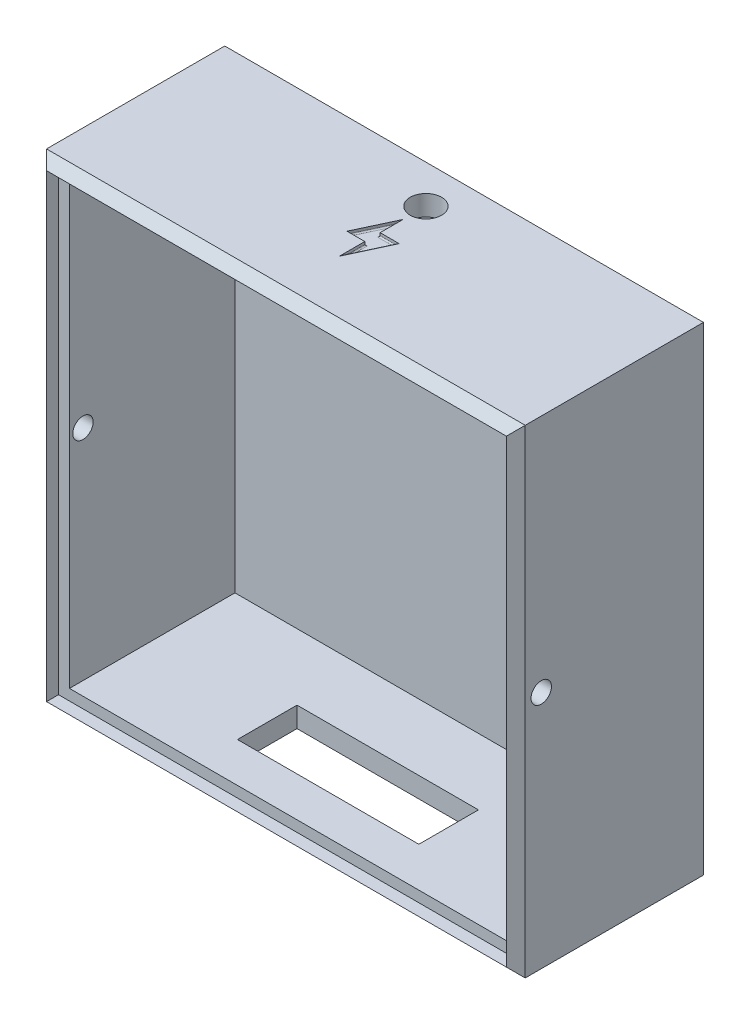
SolidWorks part; units mm, degrees
ref_plane "Ebene vorne" through (0, 0, 0) normal (0, 0, 1) x (1, 0, 0)
ref_plane "Ebene oben" through (0, 0, 0) normal (0, 1, 0) x (1, 0, 0)
ref_plane "Ebene rechts" through (0, 0, 0) normal (1, 0, 0) x (0, 0, -1)
sketch "Skizze1" plane through (0, 0, 0) normal (0, 0, 1) x (1, 0, 0)
  line L1 (-94, -94) -> (94, -94)
  line L2 (-94, -94) -> (-94, 94)
  line L3 (-94, 94) -> (94, 94)
  line L4 (94, -94) -> (94, 94)
  line L5 (-94, -94) -> (94, 94) construction
  line L6 (-94, 94) -> (94, -94) construction
  point P0 (0, 0)
  dimension "D1" = 188
  dimension "D2" = 188
extrude "Aufsatz-Linear austragen1" add sketch "Skizze1" along normal blind 4
sketch "Skizze2" plane through (0, 0, 4) normal (0, 0, 1) x (1, 0, 0)
  line L0 (0, 94) -> (0, -94) construction
  line L1 (94, 94) -> (-94, 94) construction
  line L2 (-94, -94) -> (94, -94) construction
  line L3 (-94, 0) -> (94, 0) construction
  line L4 (-94, 94) -> (-94, -94) construction
  line L5 (94, -94) -> (94, 94) construction
  line L7 (-86, -86) -> (86, -86)
  line L8 (-86, -86) -> (-86, 86)
  line L9 (-86, 86) -> (86, 86)
  line L10 (86, -86) -> (86, 86)
  line L11 (-86, -86) -> (86, 86) construction
  line L12 (-86, 86) -> (86, -86) construction
  line L13 (-94, -94) -> (94, -94)
  line L14 (-94, -94) -> (-94, 94)
  line L15 (-94, 94) -> (94, 94)
  line L16 (94, -94) -> (94, 94)
  line L17 (-94, -94) -> (94, 94) construction
  line L18 (-94, 94) -> (94, -94) construction
  point P12 (0, 0)
  point P18 (0, 0)
  dimension "D1" = 8
  dimension "D2" = 8
extrude "Aufsatz-Linear austragen2" add sketch "Skizze2" along normal blind 70
sketch "Skizze3" plane through (0, -94, 0) normal (0, -1, 0) x (-1, 0, 0)
  line L0 (0, -74) -> (0, 0) construction
  line L1 (94, -74) -> (-94, -74) construction
  line L2 (94, 0) -> (-94, 0) construction
  line L4 (35.625, -30) -> (-35.625, -30)
  line L5 (35.625, -30) -> (35.625, -53.4)
  line L6 (35.625, -53.4) -> (-35.625, -53.4)
  line L7 (-35.625, -30) -> (-35.625, -53.4)
  line L8 (35.625, -30) -> (-35.625, -53.4) construction
  line L9 (35.625, -53.4) -> (-35.625, -30) construction
  point P6 (0, -41.7)
  dimension "D1" = 71.25
  dimension "D2" = 23.4
  dimension "D3" = 30
extrude "Schnitt-Linear austragen1" cut sketch "Skizze3" against normal blind 70
sketch "Skizze4" plane through (0, 0, 74) normal (0, 0, 1) x (1, 0, 0)
  line L0 (0, 94) -> (0, -94) construction
  line L1 (94, 94) -> (-94, 94) construction
  line L2 (-94, -94) -> (94, -94) construction
  line L3 (-94, 0) -> (94, 0) construction
  line L4 (-94, 94) -> (-94, -94) construction
  line L5 (94, -94) -> (94, 94) construction
  line L7 (-90.3, -90.3) -> (90.3, -90.3)
  line L8 (-90.3, -90.3) -> (-90.3, 90.3)
  line L9 (-90.3, 90.3) -> (90.3, 90.3)
  line L10 (90.3, -90.3) -> (90.3, 90.3)
  line L11 (-90.3, -90.3) -> (90.3, 90.3) construction
  line L12 (-90.3, 90.3) -> (90.3, -90.3) construction
  point P12 (0, 0)
  dimension "D1" = 3.7
  dimension "D2" = 3.7
extrude "Schnitt-Linear austragen2" cut sketch "Skizze4" against normal blind 5
chamfer "Fase1" distance 4 angle 45 4 edges at (0, 94, 74) (94, 0, 74) (0, -94, 74) (-94, 0, 74)
sketch "Skizze5" plane through (94, 0, 0) normal (1, 0, 0) x (0, 0, -1)
  line L0 (-73.7, 0) -> (0, 0) construction
  line L1 (-73.7, -90.3) -> (-73.7, 90.3) construction
  circle A0 centre (-63.7, 0) radius 4
  dimension "D1" = 8
  dimension "D2" = 10
extrude "Schnitt-Linear austragen3" cut sketch "Skizze5" against normal blind 321
sketch "Skizze6" plane through (0, 94, 0) normal (0, 1, 0) x (1, 0, 0)
  line L0 (0, 0) -> (0, -70) construction
  line L1 (-94, -70) -> (94, -70) construction
  line L2 (94, 0) -> (-94, 0) construction
  circle A0 centre (0, -15) radius 6.15
  dimension "D1" = 15
extrude "Schnitt-Linear austragen4" cut sketch "Skizze6" against normal blind 30
sketch "Skizze7" plane through (0, -94, 0) normal (0, -1, 0) x (-1, 0, 0)
  line L0 (-66.6275, -70) -> (-66.6275, 0) construction
  line L1 (-94, -70) -> (94, -70) construction
  line L2 (94, 0) -> (-94, 0) construction
  circle A0 centre (-66.6275, -15) radius 6.15
  dimension "D1" = 12.3
  dimension "D2" = 15
extrude "Schnitt-Linear austragen5" cut sketch "Skizze7" against normal blind 30
sketch "Skizze8" plane through (0, -94, 0) normal (0, -1, 0) x (-1, 0, 0)
  line L0 (-66.6275, -15) -> (-66.6275, -70) construction
  line L1 (-94, -70) -> (94, -70) construction
  line L2 (94, 0) -> (-94, 0) construction
  line L3 (-51.6275, -25) -> (-81.6275, -25)
  line L4 (-51.6275, -25) -> (-51.6275, -37)
  line L5 (-51.6275, -37) -> (-81.6275, -37)
  line L6 (-81.6275, -25) -> (-81.6275, -37)
  line L7 (-51.6275, -25) -> (-81.6275, -37) construction
  line L8 (-51.6275, -37) -> (-81.6275, -25) construction
  point P5 (-66.6275, -31)
  dimension "D1" = 30
  dimension "D2" = 12
  dimension "D3" = 25
extrude "Schnitt-Linear austragen6" cut sketch "Skizze8" against normal blind 1.5
fillet "Verrundung3" radius 1 4 edges at (66.6275, -94, 25) (81.6275, -94, 31) (66.6275, -94, 37) (51.6275, -94, 31)
sketch "Skizze9" plane through (0, -92.5, 0) normal (0, -1, 0) x (-1, 0, 0)
  line L0 (-58.6275, -37) -> (-58.6275, -25) construction
  line L1 (-81.6275, -37) -> (-51.6275, -37) construction
  line L2 (-51.6275, -25) -> (-81.6275, -25) construction
  line L3 (-74.6275, -37) -> (-74.6275, -25) construction
  line L4 (-51.6275, -37) -> (-51.6275, -25) construction
  line L5 (-57.3775, -27) -> (-59.8775, -27)
  line L6 (-57.3775, -27) -> (-57.3775, -35)
  line L7 (-57.3775, -35) -> (-59.8775, -35)
  line L8 (-59.8775, -27) -> (-59.8775, -35)
  line L9 (-57.3775, -27) -> (-59.8775, -35) construction
  line L10 (-57.3775, -35) -> (-59.8775, -27) construction
  line L11 (-54.6275, -29.75) -> (-62.6275, -29.75)
  line L12 (-54.6275, -29.75) -> (-54.6275, -32.25)
  line L13 (-54.6275, -32.25) -> (-62.6275, -32.25)
  line L14 (-62.6275, -29.75) -> (-62.6275, -32.25)
  line L15 (-54.6275, -29.75) -> (-62.6275, -32.25) construction
  line L16 (-54.6275, -32.25) -> (-62.6275, -29.75) construction
  line L17 (-81.6275, -25) -> (-81.6275, -37) construction
  line L18 (-81.6275, -31) -> (-51.6275, -31) construction
  circle A0 centre (-74.6275, -33.7) radius 1.3
  circle A1 centre (-74.6275, -28.3) radius 1.3
  circle A2 centre (-77.3275, -31) radius 1.3
  circle A3 centre (-71.9275, -31) radius 1.3
  point P8 (-58.6275, -31)
  point P13 (-58.6275, -31)
  dimension "D7" = 2.6
  dimension "D9" = 2.6
  dimension "D11" = 2.6
  dimension "D1" = 2.5
  dimension "D2" = 2.5
  dimension "D3" = 2.7
  dimension "7" = 7
  dimension "D4" = 8
  dimension "D5" = 8
  dimension "D6" = 7
  dimension "D8" = 2.7
  dimension "D10" = 5.4
extrude "Schnitt-Linear austragen7" cut sketch "Skizze9" against normal blind 1 contours L11 L14 L13 L8 | L6 L13 L8 L7 | L13 L12 L11 L6 | L13 L6 L11 L8 | L11 L6 L5 L8 | A0 | A2 | A1 | A3
fillet "Verrundung5" radius 0.5 20 edges at (74.6275, -92.5, 27) (66.6275, -92.5, 25) (51.6275, -92.5, 31) (66.6275, -92.5, 37) (81.6275, -92.5, 31) (74.6275, -92.5, 32.4) (77.3275, -92.5, 29.7) (71.9275, -92.5, 29.7) (61.2525, -92.5, 32.25) (59.8775, -92.5, 33.625) (58.6275, -92.5, 35) (57.3775, -92.5, 33.625) (56.0025, -92.5, 32.25) (54.6275, -92.5, 31) (56.0025, -92.5, 29.75) (57.3775, -92.5, 28.375) (58.6275, -92.5, 27) (59.8775, -92.5, 28.375) (61.2525, -92.5, 29.75) (62.6275, -92.5, 31)
sketch "Skizze10" plane through (0, 94, 0) normal (0, 1, 0) x (1, 0, 0)
  line L0 (0, -70) -> (0, 0) construction
  line L1 (-94, -70) -> (94, -70) construction
  line L2 (0, -47.9903) -> (7, -32.9805)
  line L3 (7, -32.9805) -> (0, -32.9805)
  line L4 (0, -32.9805) -> (0, -23.9805)
  line L5 (0, -23.9805) -> (-7, -38.9903)
  line L6 (-7, -38.9903) -> (0, -38.9903)
  line L7 (0, -38.9903) -> (0, -47.9903)
  point P7 (0, -47.9677)
  point P12 (3.0872, -22.1328)
  point P13 (0, -39.2895)
  point P14 (-7.9849, -39.09)
  point P15 (7.9749, -33.7036)
  point P16 (0.6932, -35.6986)
  point P17 (9.3714, -35.7983)
  point P18 (0, -22.6315)
  point P19 (0, -41.7833)
  point P20 (0.793, -32.8059)
  point P21 (0, -38.9903)
  point P22 (0, 0)
  point P23 (9.3251, -33.0946)
  point P24 (0, -32.9805)
  dimension "D1" = 9
  dimension "D2" = 9
  dimension "D3" = 7
  dimension "D4" = 7
extrude "Schnitt-Linear austragen8" cut sketch "Skizze10" against normal blind 1.5
fillet "Verrundung6" radius 0.5 7 edges at (-3.5, 92.5, 38.9903) (-3.5, 92.5, 31.4854) (0, 92.5, 28.4805) (3.5, 92.5, 32.9805) (3.5, 92.5, 40.4854) (0, 92.5, 43.4903) (3.5, 94, 40.4854)
